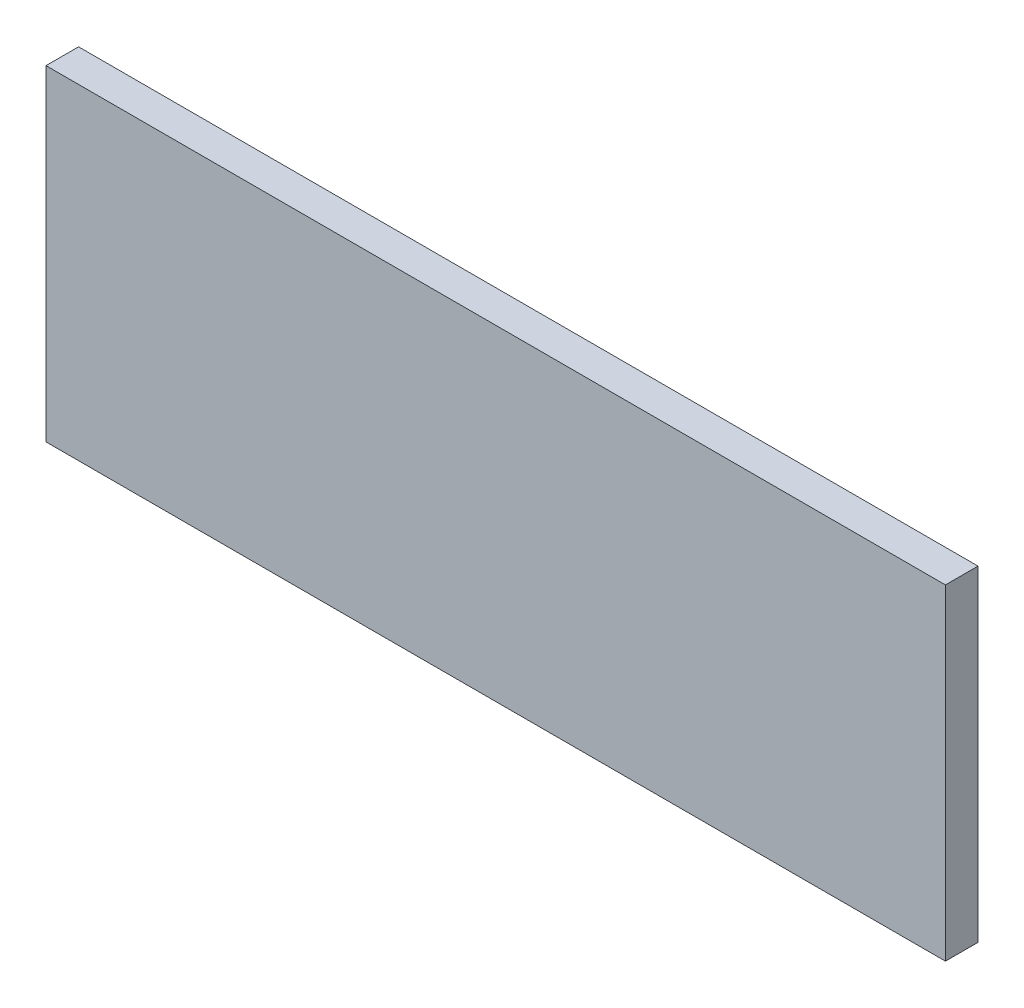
SolidWorks part; units mm, degrees
ref_plane "Front" through (0, 0, 0) normal (0, 0, 1) x (1, 0, 0)
ref_plane "Top" through (0, 0, 0) normal (0, 1, 0) x (1, 0, 0)
ref_plane "Right" through (0, 0, 0) normal (1, 0, 0) x (0, 0, -1)
body saved out of another part "Stock-Tail-1"
sketch "Sketch1" plane through (0, 0, 0) normal (0, 0, 1) x (1, 0, 0)
  line L0 (55.2, 5) -> (55.2, -5) construction
  line L1 (82.8, 5) -> (82.8, -5) construction
  point P4 (0, 0)
  point P5 (0, 0)
  point P6 (0, 0)
  point P7 (0, 0)
  point P11 (0, 0)
